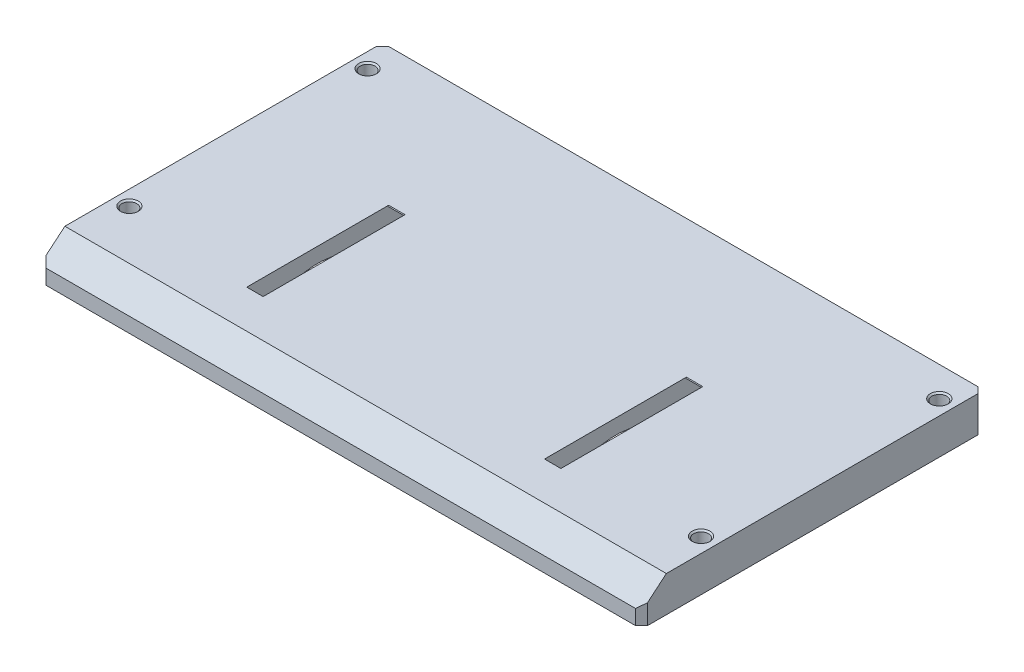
SolidWorks part; units mm, degrees
ref_plane "Front" through (0, 0, 0) normal (0, 0, 1) x (1, 0, 0)
ref_plane "Top" through (0, 0, 0) normal (0, 1, 0) x (1, 0, 0)
ref_plane "Right" through (0, 0, 0) normal (1, 0, 0) x (0, 0, -1)
sketch "Sketch1" plane through (0, 0, 0) normal (0, 1, 0) x (1, 0, 0)
  line L0 (0, 47.5) -> (0, -32.5) construction
  line L1 (101, -57.5) -> (-101, -57.5)
  line L2 (101, -57.5) -> (101, 57.5)
  line L3 (101, 57.5) -> (-101, 57.5)
  line L4 (-101, -57.5) -> (-101, 57.5)
  line L5 (101, -57.5) -> (-101, 57.5) construction
  line L6 (101, 57.5) -> (-101, -57.5) construction
  line L7 (-96, 47.5) -> (96, 47.5) construction
  line L8 (-96, 47.5) -> (-96, -32.5) construction
  line L9 (-96, -32.5) -> (96, -32.5) construction
  line L10 (96, 47.5) -> (96, -32.5) construction
  circle A0 centre (96, 47.5) radius 2.5
  circle A1 centre (96, -32.5) radius 2.5
  circle A2 centre (-96, 47.5) radius 2.5
  circle A3 centre (-96, -32.5) radius 2.5
  point P0 (0, 0)
  dimension "D5" = 5
  dimension "D1" = 202
  dimension "D2" = 115
  dimension "D3" = 10
  dimension "D4" = 5
  dimension "D6" = 80
extrude "Boss-Extrude1" add sketch "Sketch1" along normal blind 12
chamfer "Chamfer1" distance 0.5 angle 45 8 edges at (96, 0, 35) (96, 12, 35) (96, 0, -45) (96, 12, -45) (-96, 0, 35) (-96, 12, 35) (-96, 0, -45) (-96, 12, -45)
chamfer "Chamfer2" distance 2 angle 45 4 edges at (-101, 6, -57.5) (-101, 6, 57.5) (101, 6, 57.5) (101, 6, -57.5)
ref_plane "Plane1" through (50, 0, 0) normal (1, 0, 0) x (0, 0, -1)
sketch "Sketch3" plane through (50, 0, 0) normal (1, 0, 0) x (0, 0, -1)
  line L0 (-55.5, 0) -> (55.5, 0) construction
  line L1 (-57.5, 0) -> (-57.5, 12) construction
  circle A0 centre (-12.5, -18) radius 38
  dimension "D1" = 76
  dimension "D2" = 18
  dimension "D3" = 45
extrude "Cut-Extrude1" cut sketch "Sketch3" against normal mid plane 5.5
mirror "Mirror1" about plane through (0, 0, 0) normal (1, 0, 0) of "Cut-Extrude1"
chamfer "Chamfer3" distance 0.5 angle 45 8 edges at (50, 0, 45.9664) (50, 0, -20.9664) (50, 12, 35.8238) (50, 12, -10.8238) (-50, 0, -20.9664) (-50, 0, 45.9664) (-50, 12, -10.8238) (-50, 12, 35.8238)
sketch "Sketch4" plane through (0, 0, 0) normal (1, 0, 0) x (0, 0, -1)
  circle A0 centre (-12.5, -18) radius 25
  dimension "D1" = 50
extrude "Cut-Extrude2" cut sketch "Sketch4" against normal mid plane 150
chamfer "Chamfer4" distance 7 angle 50 1 edges at (0, 12, 57.5)
